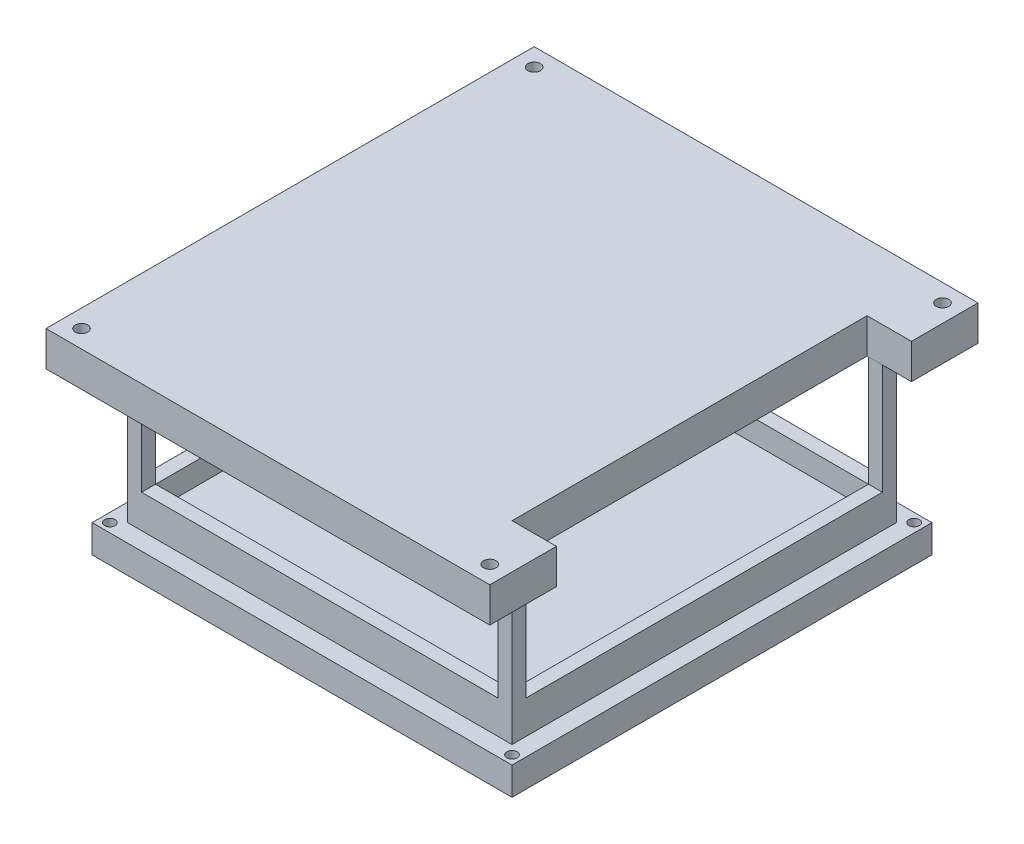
SolidWorks part; units mm, degrees
ref_plane "Front Plane" through (0, 0, 0) normal (0, 0, 1) x (1, 0, 0)
ref_plane "Top Plane" through (0, 0, 0) normal (0, 1, 0) x (1, 0, 0)
ref_plane "Right Plane" through (0, 0, 0) normal (1, 0, 0) x (0, 0, -1)
sketch "Sketch1" plane through (0, 0, 0) normal (0, 1, 0) x (1, 0, 0)
  line L1 (-55, -55) -> (55, -55)
  line L2 (-55, -55) -> (-55, 55)
  line L3 (-55, 55) -> (55, 55)
  line L4 (55, -55) -> (55, 55)
  line L5 (-55, -55) -> (55, 55) construction
  line L6 (-55, 55) -> (55, -55) construction
  point P0 (0, 0)
  dimension "D1" = 110
  dimension "D2" = 110
extrude "Boss-Extrude1" add sketch "Sketch1" along normal blind 9.525
sketch "Sketch3" plane through (0, 0, 0) normal (0, -1, 0) x (1, 0, 0)
  line L0 (55, 55) -> (55, -55) construction
  line L1 (-60.08, -60.08) -> (60.08, -60.08)
  line L2 (-60.08, -60.08) -> (-60.08, 60.08)
  line L3 (-60.08, 60.08) -> (60.08, 60.08)
  line L4 (60.08, -60.08) -> (60.08, 60.08)
  line L5 (-60.08, -60.08) -> (60.08, 60.08) construction
  line L6 (-60.08, 60.08) -> (60.08, -60.08) construction
  line L7 (-55, 55) -> (55, 55) construction
  point P0 (0, 0)
  dimension "D1" = 5.08
  dimension "D2" = 5.08
extrude "Boss-Extrude2" add sketch "Sketch3" along normal blind 8
sketch "Sketch4" plane through (0, 0, 0) normal (0, 1, 0) x (1, 0, 0)
  line L0 (-60.08, 60.08) -> (-55, 60.08) construction
  line L1 (-55, 55) -> (-55, 60.08) construction
  line L2 (-60.08, 60.08) -> (60.08, 60.08) construction
  line L3 (0, -5.2388) -> (0, 5.2388) construction
  line L4 (55, 55) -> (55, 60.08) construction
  line L5 (60.08, 60.08) -> (55, 60.08) construction
  line L6 (-5.2388, 0) -> (5.2388, 0) construction
  line L7 (60.08, -60.08) -> (55, -60.08) construction
  line L8 (55, -55) -> (55, -60.08) construction
  line L9 (-55, -55) -> (-55, -60.08) construction
  line L10 (-60.08, -60.08) -> (-55, -60.08) construction
  circle A0 centre (-57.54, 57.54) radius 1.5
  circle A1 centre (57.54, 57.54) radius 1.5
  circle A2 centre (57.54, -57.54) radius 1.5
  circle A3 centre (-57.54, -57.54) radius 1.5
  point P10 (-57.54, 60.08)
  point P11 (-55, 57.54)
  dimension "D1" = 3
extrude "Cut-Extrude2" cut sketch "Sketch4" against normal through all
sketch "Sketch2" plane through (0, 9.525, 0) normal (0, 1, 0) x (1, 0, 0)
  line L1 (-51, -51) -> (51, -51)
  line L2 (-51, -51) -> (-51, 51)
  line L3 (-51, 51) -> (51, 51)
  line L4 (51, -51) -> (51, 51)
  line L5 (-51, -51) -> (51, 51) construction
  line L6 (-51, 51) -> (51, -51) construction
  point P0 (0, 0)
  dimension "D1" = 102
  dimension "D2" = 102
extrude "Cut-Extrude1" cut sketch "Sketch2" against normal blind 6.35
sketch "Sketch5" plane through (0, 9.525, 0) normal (0, 1, 0) x (1, 0, 0)
  line L0 (-5.2388, 0) -> (5.2388, 0) construction
  line L1 (-55, 55) -> (-51, 55)
  line L2 (-55, 55) -> (-55, 51)
  line L3 (-55, 51) -> (-51, 51)
  line L4 (-51, 55) -> (-51, 51)
  line L5 (-55, -51) -> (-51, -51)
  line L6 (-51, -55) -> (-51, -51)
  line L7 (-55, -55) -> (-51, -55)
  line L8 (-55, -55) -> (-55, -51)
  line L9 (0, -5.2388) -> (0, 5.2388) construction
  line L10 (55, -55) -> (55, -51)
  line L11 (55, -55) -> (51, -55)
  line L12 (51, -55) -> (51, -51)
  line L13 (55, -51) -> (51, -51)
  line L14 (55, 51) -> (51, 51)
  line L15 (51, 55) -> (51, 51)
  line L16 (55, 55) -> (51, 55)
  line L17 (55, 55) -> (55, 51)
extrude "Boss-Extrude3" add sketch "Sketch5" along normal blind 31.75
ref_plane "Plane1" through (0, 41.275, 0) normal (0, 1, 0) x (1, 0, 0)
sketch "Sketch7" plane through (0, 0, 0) normal (1, 0, 0) x (0, 0, -1)
  line L0 (0, 0) -> (0, 50000) construction
sketch "Sketch8" plane through (0, 41.275, 0) normal (0, 1, 0) x (1, 0, 0)
  line L1 (-63.5, 69.85) -> (63.5, 69.85)
  line L2 (-63.5, 69.85) -> (-63.5, -69.85)
  line L3 (-63.5, -69.85) -> (63.5, -69.85)
  line L4 (63.5, 69.85) -> (63.5, -69.85)
  line L5 (-63.5, 69.85) -> (63.5, -69.85) construction
  line L6 (-63.5, -69.85) -> (63.5, 69.85) construction
  point P0 (0, 0)
  dimension "D1" = 127
  dimension "D2" = 139.7
extrude "Boss-Extrude4" add sketch "Sketch8" along normal blind 10
sketch "Sketch11" plane through (0, 41.275, 0) normal (0, 1, 0) x (1, 0, 0)
  line L0 (-63.5, 69.85) -> (-63.5, -69.85) construction
  line L1 (63.5, 69.85) -> (-63.5, 69.85) construction
  line L2 (0, -32.6013) -> (0, 32.6013) construction
  line L4 (-63.5, -69.85) -> (63.5, -69.85) construction
  circle A0 centre (-58.42, 64.77) radius 1.778
  circle A1 centre (58.42, 64.77) radius 1.778
  circle A2 centre (-58.42, -64.77) radius 1.778
  circle A3 centre (58.42, -64.77) radius 1.778
  point P12 (0, 0)
  point P14 (-70.4268, -67.6216)
  point P15 (-70.0942, -69.1463)
  dimension "D3" = 3.556
  dimension "D4" = 5.08
  dimension "D6" = 3.556
  dimension "D1" = 5.08
  dimension "D2" = 5.08
  dimension "D5" = 5.08
extrude "Cut-Extrude4" cut sketch "Sketch11" along normal blind 10
sketch "Sketch13" plane through (0, 51.275, 0) normal (0, 1, 0) x (1, 0, 0)
  line L0 (63.5, -69.85) -> (63.5, 69.85) construction
  line L1 (63.5, -50.8) -> (63.5, 50.8) construction
  line L3 (63.5, 50.8) -> (50.8, 50.8)
  line L4 (63.5, 50.8) -> (63.5, -50.8)
  line L5 (63.5, -50.8) -> (50.8, -50.8)
  line L6 (50.8, 50.8) -> (50.8, -50.8)
  line L7 (63.5, 50.8) -> (50.8, -50.8) construction
  line L8 (63.5, -50.8) -> (50.8, 50.8) construction
  point P9 (63.5, 0)
  point P12 (57.15, 0)
  point P13 (0, 0)
  point P14 (0, 0)
  dimension "D1" = 139.7
  dimension "D2" = 101.6
  dimension "D3" = 12.7
extrude "Cut-Extrude5" cut sketch "Sketch13" against normal blind 10
